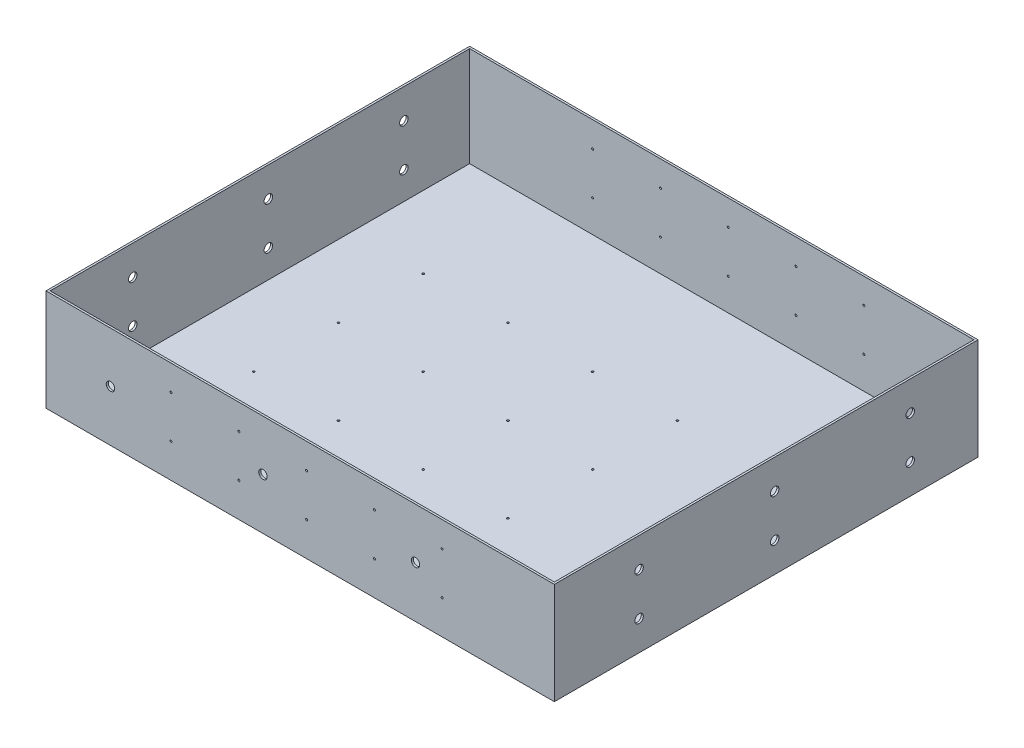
SolidWorks part; units mm, degrees
ref_plane "Front Plane" through (0, 0, 0) normal (0, 0, 1) x (1, 0, 0)
ref_plane "Top Plane" through (0, 0, 0) normal (0, 1, 0) x (1, 0, 0)
ref_plane "Right Plane" through (0, 0, 0) normal (1, 0, 0) x (0, 0, -1)
sketch "Sketch1" plane through (0, 0, 0) normal (0, 1, 0) x (1, 0, 0)
  line L1 (-508, 508) -> (254, 508)
  line L2 (-508, 508) -> (-508, -127)
  line L3 (-508, -127) -> (254, -127)
  line L4 (254, 508) -> (254, -127)
  dimension "D1" = 508
  dimension "D2" = 635
  dimension "D3" = 762
  dimension "D4" = 508
extrude "Extrude1" add sketch "Sketch1" along normal blind 152.4
shell "Shell1" thickness 3.048
sketch "Sketch2" plane through (-508, 0, 0) normal (-1, 0, 0) x (0, 0, 1)
  line L0 (-508, 152.4) -> (-508, 0) construction
  line L1 (-504.952, 152.4) -> (123.952, 152.4) construction
  circle A0 centre (-406.4, 107.95) radius 6.35
  dimension "D1" = 12.7
  dimension "D2" = 101.6
  dimension "D3" = 44.45
extrude "Connector mount--Cut-Extrude1" cut sketch "Sketch2" against normal through all
pattern_linear "LPattern1" count 3 spacing 203.2 along (0, 0, 1) count 2 spacing 63.5 along (0, -1, 0) of "Connector mount--Cut-Extrude1"
sketch "Sketch3" plane through (0, 0, -508) normal (0, 0, -1) x (-1, 0, 0)
  line L0 (-250.952, 152.4) -> (-250.952, 3.048) construction
  line L1 (-250.952, 152.4) -> (504.952, 152.4) construction
  circle A0 centre (-85.852, 114.3) radius 1.524
  dimension "D1" = 3.048
  dimension "D3" = 38.1
  dimension "D2" = 165.1
extrude "Clip Mount --Cut-Extrude2" cut sketch "Sketch3" against normal through all
pattern_linear "LPattern2" count 5 spacing 101.6 along (-1, 0, 0) count 2 spacing 63.5 along (0, -1, 0) of "Clip Mount --Cut-Extrude2"
sketch "Sketch4" plane through (0, 0, 127) normal (0, 0, 1) x (1, 0, 0)
  circle A0 centre (-411.3748, 76.774) radius 6.35
  dimension "D1" = 12.7
extrude "Lower Connector Mnt--Cut-Extrude1" cut sketch "Sketch4" against normal up to surface (3.048 mm away)
pattern_linear "LPattern3" count 3 spacing 228.6 along (1, 0, 0) of "Lower Connector Mnt--Cut-Extrude1"
sketch "Sketch5" plane through (0, 3.048, 0) normal (0, 1, 0) x (-1, 0, 0)
  line L0 (-250.952, 123.952) -> (-250.952, -504.952) construction
  line L1 (-250.952, -504.952) -> (504.952, -504.952) construction
  circle A0 centre (-111.252, -327.152) radius 1.524
  dimension "D1" = 3.048
  dimension "D2" = 139.7
  dimension "D3" = 177.8
extrude "Cut-Extrude1" cut sketch "Sketch5" against normal up to surface (3.048 mm away)
pattern_linear "LPattern4" count 3 spacing 127 along (0, 0, 1) count 5 spacing 127 along (-1, 0, 0) of "Cut-Extrude1"
